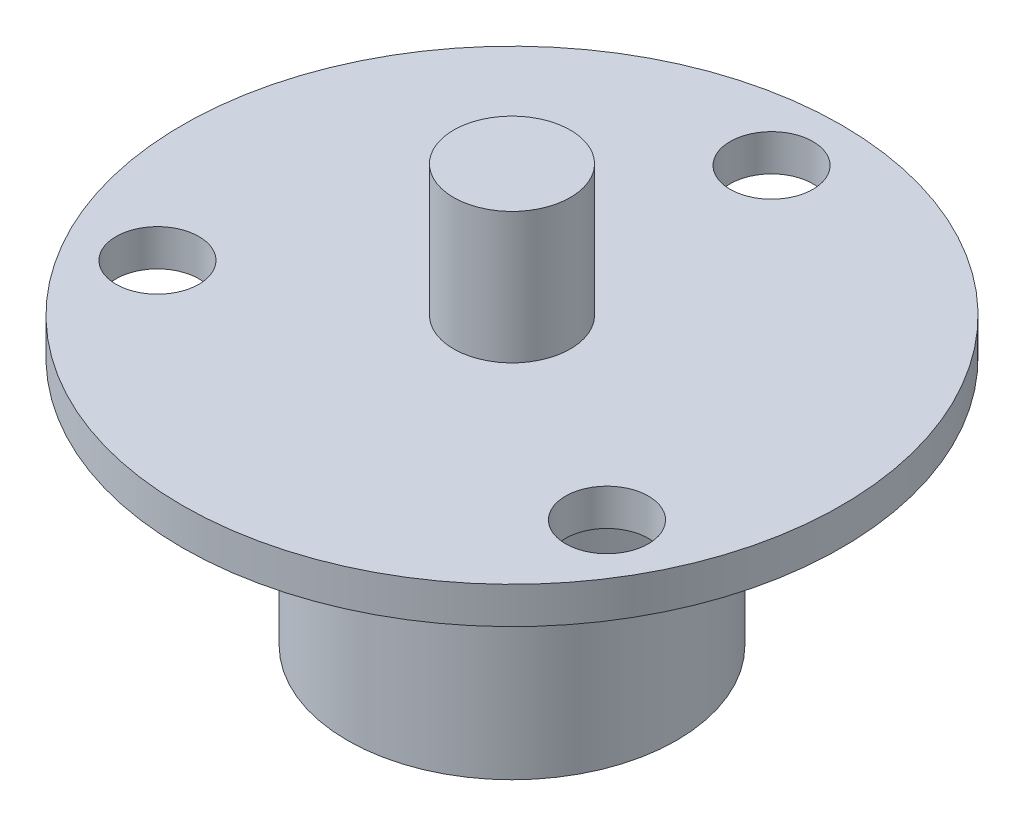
SolidWorks part; units mm, degrees
ref_plane "Front Plane" through (0, 0, 0) normal (0, 0, 1) x (1, 0, 0)
ref_plane "Top Plane" through (0, 0, 0) normal (0, 1, 0) x (1, 0, 0)
ref_plane "Right Plane" through (0, 0, 0) normal (1, 0, 0) x (0, 0, -1)
sketch "Sketch1" plane through (0, 0, 0) normal (0, 1, 0) x (1, 0, 0)
  circle A0 centre (0, 0) radius 10.9601
  dimension "D1" = 21.9202
extrude "Boss-Extrude1" add sketch "Sketch1" along normal blind 16.5862
sketch "Sketch2" plane through (0, 16.5862, 0) normal (0, 1, 0) x (1, 0, 0)
  circle A0 centre (0, 0) radius 21.9329
  circle A1 centre (0, 17.272) radius 2.7559
  circle A2 centre (14.958, -8.636) radius 2.7559
  circle A3 centre (-14.958, -8.636) radius 2.7559
  point P12 (0, 0)
  dimension "D1" = 43.8658
  dimension "D2" = 5.5118
  dimension "D3" = 17.272
  dimension "D4" = 3
extrude "Boss-Extrude2" add sketch "Sketch2" along normal blind 2.4384
sketch "Sketch3" plane through (0, 19.0246, 0) normal (0, 1, 0) x (1, 0, 0)
  circle A0 centre (0, 0) radius 3.8862
  dimension "D1" = 7.7724
extrude "Boss-Extrude3" add sketch "Sketch3" along normal blind 8.7312
